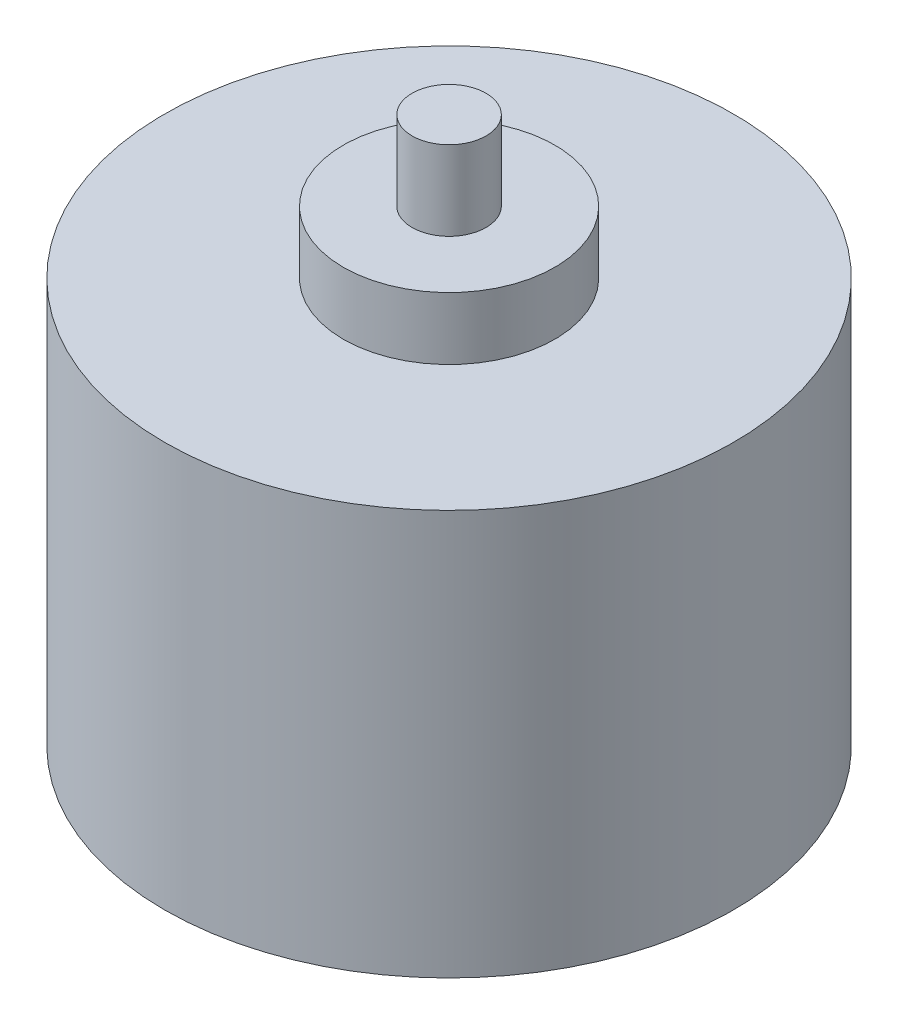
SolidWorks part; units mm, degrees
ref_plane "Front Plane" through (0, 0, 0) normal (0, 0, 1) x (1, 0, 0)
ref_plane "Top Plane" through (0, 0, 0) normal (0, 1, 0) x (1, 0, 0)
ref_plane "Right Plane" through (0, 0, 0) normal (1, 0, 0) x (0, 0, -1)
sketch "Sketch1" plane through (0, 0, 0) normal (0, 1, 0) x (1, 0, 0)
  circle A0 centre (0, 0) radius 12.75
  dimension "D1" = 25.5
extrude "Extrude1" add sketch "Sketch1" along normal blind 18.15
sketch "Sketch2" plane through (0, 18.15, 0) normal (0, 1, 0) x (-1, 0, 0)
  circle A0 centre (0, 0) radius 1.6573
  dimension "D1" = 3.3147
extrude "Extrude2" add sketch "Sketch2" along normal blind 6.35
sketch "Sketch4" plane through (0, 0, 0) normal (0, -1, 0) x (1, 0, 0)
  circle A0 centre (0, 0) radius 4.7435
extrude "Extrude4" add sketch "Sketch4" along normal blind 1.016
sketch "Sketch5" plane through (0, -1.016, 0) normal (0, -1, 0) x (1, 0, 0)
  circle A0 centre (0, 0) radius 1.6573
extrude "Extrude5" add sketch "Sketch5" along normal blind 6.35
sketch "Sketch6" plane through (0, 18.15, 0) normal (0, 1, 0) x (-1, 0, 0)
  circle A0 centre (0, 0) radius 4.7435
extrude "Extrude6" add sketch "Sketch6" along normal blind 2.794
